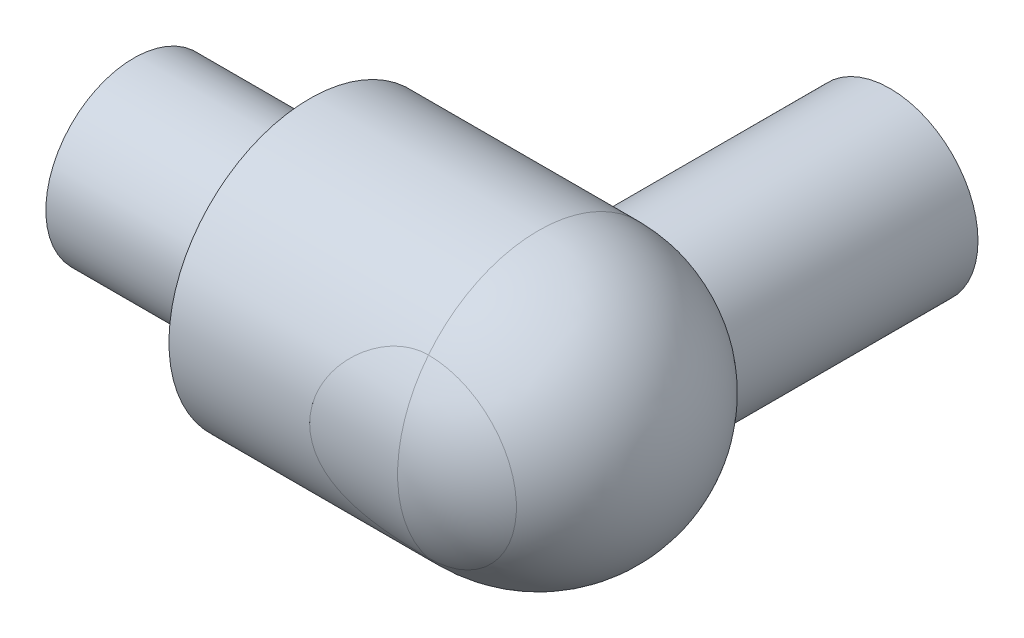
SolidWorks part; units mm, degrees
ref_plane "Спереди" through (0, 0, 0) normal (0, 0, 1) x (1, 0, 0)
ref_plane "Сверху" through (0, 0, 0) normal (0, 1, 0) x (1, 0, 0)
ref_plane "Справа" through (0, 0, 0) normal (1, 0, 0) x (0, 0, -1)
sketch "Эскиз3" plane through (0, 0, 0) normal (1, 0, 0) x (0, 0, -1)
  circle A0 centre (0, 0) radius 5
  dimension "D1" = 10
extrude "Бобышка-Вытянуть2" add sketch "Эскиз3" along normal blind 10
sketch "Эскиз4" plane through (10, 0, 0) normal (1, 0, 0) x (0, 0, -1)
  circle A0 centre (0, 0) radius 8
  dimension "D1" = 16
extrude "Бобышка-Вытянуть3" add sketch "Эскиз4" along normal blind 21
sketch "Эскиз6" plane through (0, 0, 0) normal (0, 0, 1) x (1, 0, 0)
  line L1 (31, -8) -> (31, 8) construction
  circle A0 centre (23, 0) radius 8 construction
  circle A1 centre (23, 0) radius 5
  dimension "D1" = 10
  dimension "D2" = 16
extrude "Вырез-Вытянуть3" cut sketch "Эскиз6" against normal mid plane 20.94
sketch "Эскиз7" plane through (0, 0, 0) normal (0, 0, 1) x (1, 0, 0)
  circle A0 centre (23, 0) radius 5 construction
  circle A1 centre (23, 0) radius 5
extrude "Бобышка-Вытянуть4" add sketch "Эскиз7" along normal mid plane 20.94 separate body
sketch "Эскиз8" plane through (0, 0, 0) normal (0, 0, 1) x (1, 0, 0)
  line L3 (0, 0) -> (23, 0) construction
  line L4 (31, 0) -> (36, 0)
  line L5 (10, 8) -> (10, -8) construction
  line L6 (10, 13) -> (36, 13)
  line L8 (36, 0) -> (36, 13)
  line L10 (10, 13) -> (10, 8)
  line L11 (10, 8) -> (23, 8)
  arc A0 (31, 0) -> (23, 8) centre (23, 0) ccw
  dimension "D1" = 16
  dimension "D2" = 5
  dimension "D3" = 5
revolve "Вырез-Повернуть7" cut sketch "Эскиз8" angle 360 about L3
ref_plane "Плоскость1" through (0, 0, -20) normal (0, 0, 1) x (1, 0, 0)
sketch "Эскиз9" plane through (0, 0, -20) normal (0, 0, 1) x (1, 0, 0)
  line L0 (23, 5) -> (23, -5) construction
  circle A0 centre (23, 0) radius 5
extrude "Бобышка-Вытянуть6" add sketch "Эскиз9" along normal up to surface (13.755 mm away) separate body
combine bodies "Соединить1" operation type add bodies to combine 111 110
